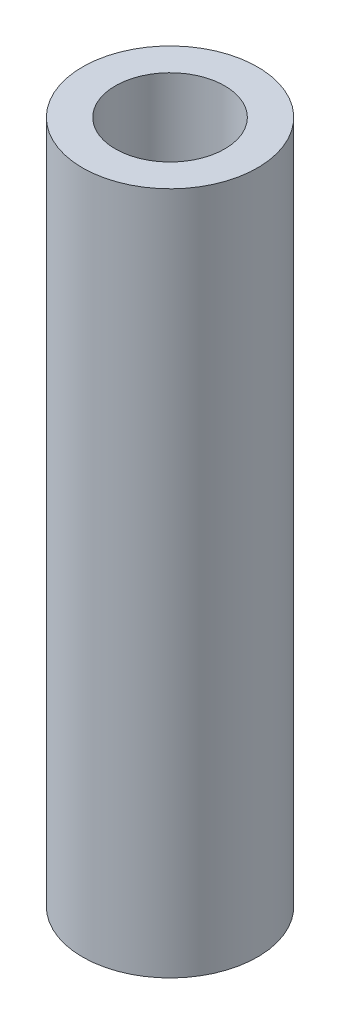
SolidWorks part; units mm, degrees
ref_plane "Front Plane" through (0, 0, 0) normal (0, 0, 1) x (1, 0, 0)
ref_plane "Top Plane" through (0, 0, 0) normal (0, 1, 0) x (1, 0, 0)
ref_plane "Right Plane" through (0, 0, 0) normal (1, 0, 0) x (0, 0, -1)
sketch "Sketch1" plane through (0, 0, 0) normal (0, 1, 0) x (1, 0, 0)
  circle A0 centre (0, 0) radius 2.4812
  circle A1 centre (0, 0) radius 3.9688
  dimension "D1" = 4.9625
  dimension "D2" = 7.9375
extrude "Boss-Extrude1" add sketch "Sketch1" along normal blind 31
